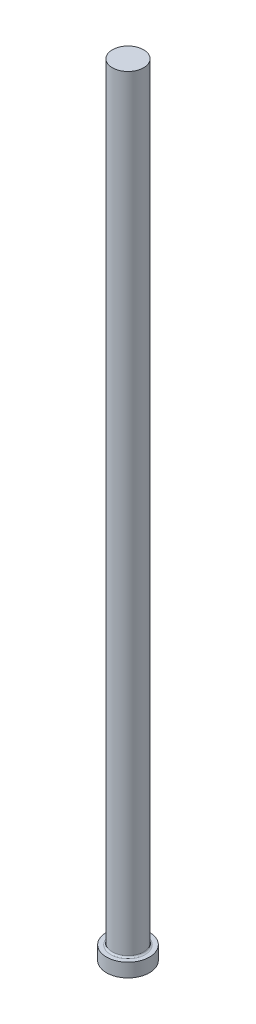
SolidWorks part; units mm, degrees
ref_plane "Plano frontal" through (0, 0, 0) normal (0, 0, 1) x (1, 0, 0)
ref_plane "Plano superior" through (0, 0, 0) normal (0, 1, 0) x (1, 0, 0)
ref_plane "Plano direito" through (0, 0, 0) normal (1, 0, 0) x (0, 0, -1)
sketch "Esboço1" plane through (0, 0, 0) normal (0, 0, 1) x (1, 0, 0)
  line L0 (0, 0) -> (11, 0)
  line L1 (11, 0) -> (11, 7)
  line L2 (11, 7) -> (8.8, 7)
  line L3 (8, 7.8) -> (8, 400)
  line L4 (8, 400) -> (0, 400)
  line L5 (0, 400) -> (0, 0) construction
  line L6 (0, 0) -> (0, 400)
  arc A0 (8.8, 7) -> (8, 7.8) centre (8.8, 7.8) cw
  dimension "D3" = 0.8
  dimension "D1" = 22
  dimension "D2" = 16
  dimension "D4" = 7
  dimension "D5" = 400
revolve "Revolução1" add sketch "Esboço1" angle 360 about L5
sketch "Esboço2"
  dimension "D1" = 0.825
  dimension "D2" = 1.925
  dimension "D3" = 1.2375
  dimension "D4" = 5.9125
wrap "Envolver1" sketch "Esboço2" wrap type deboss source sketch "Esboço2" thickness 0.1 parameters "D1"=0.1
